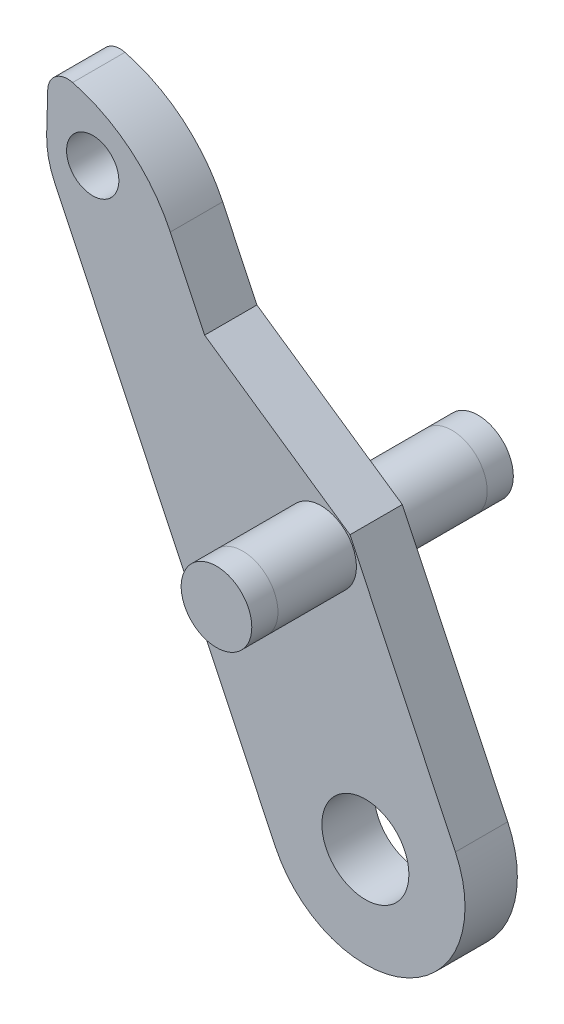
SolidWorks part; units mm, degrees
ref_plane "Plane1" through (0, 0, 0) normal (0, 0, 1) x (1, 0, 0)
ref_plane "Plane2" through (0, 0, 0) normal (0, 1, 0) x (1, 0, 0)
ref_plane "Plane3" through (0, 0, 0) normal (1, 0, 0) x (0, 0, -1)
sketch "Sketch1" plane through (0, 0, 0) normal (0, 0, 1) x (1, 0, 0)
  line L10 (91.8084, 36.1301) -> (100.2474, 18.3577)
  line L11 (107.1308, 21.6262) -> (103.0997, 30.1157)
  line L26 (103.0997, 30.1157) -> (97.5422, 33.944)
  line L27 (97.5422, 33.944) -> (96.2312, 36.705)
  line L28 (91.5444, 39.0709) -> (91.5028, 37.5807)
  circle A3 centre (103.6891, 19.992) radius 1.6637
  arc A16 (100.2474, 18.3577) -> (107.1308, 21.6262) centre (103.6891, 19.992) ccw
  arc A31 (96.2312, 36.705) -> (92.4965, 39.7874) centre (91.0686, 34.2537) ccw
  arc A32 (92.4965, 39.7874) -> (91.5444, 39.0709) centre (92.3061, 39.0496) ccw
  arc A33 (91.5028, 37.5807) -> (91.8084, 36.1301) centre (94.6765, 37.492) ccw
  dimension "D1" = 3.81
  dimension "D2" = 5.715
  dimension "D3" = 0.762
  dimension "D4" = 3.175
  dimension "D6" = 19.0576
  dimension "D7" = 11.383
  dimension "D11" = 3.3274
  dimension "D5" = 19.6742
  dimension "D8" = 3.0565
  dimension "D9" = 149.961
  dimension "D10" = 4.2418
extrude "Base-Extrude" add sketch "Sketch1" along normal mid plane 2
sketch "Sketch2" plane through (0, 0, 0) normal (0, 0, 1) x (1, 0, 0)
  circle A1 centre (102.105, 29.2498) radius 1.2446
  dimension "D1" = 2.4892
sketch "Sketch3" plane through (0, 0, 1) normal (0, 0, 1) x (1, 0, 0)
  circle A0 centre (93.2638, 37.4211) radius 1
  dimension "D1" = 2
extrude "Cut-Extrude1" cut sketch "Sketch3" against normal through all
sketch "Sketch8" plane through (0, 0, 0) normal (0, 0, 1) x (1, 0, 0)
  line L0 (103.0997, 30.1157) -> (97.5422, 33.944) construction
  line L1 (107.1308, 21.6262) -> (103.0997, 30.1157) construction
  circle A0 centre (101.9961, 29.1759) radius 1.35
  point P0 (101.9961, 29.1759)
  dimension "D1" = 1.4
  dimension "D2" = 1.4
extrude "Extrude1" add sketch "Sketch8" along normal blind 5 and the other way blind 5
sketch "Sketch5" plane through (95.7999, 45.4891, 0) normal (0.9033, 0.4289, 0) x (0, 0, -1)
  line L0 (-5, -16.0441) -> (-5, -18.7441) construction
  line L1 (-4, -12.8969) -> (-4, -22.5176)
  dimension "D1" = 1
sketch "Sketch7" plane through (97.284, 42.3636, -3.9009) normal (0.9033, 0.4289, 0) x (0, 0, -1)
  line L1 (0.0991, -7.8724) -> (0.0991, -22.5176)
  line L2 (-2.9009, -22.9564) -> (-2.9009, -13.5584) construction
  line L3 (1.0991, -15.2841) -> (1.0991, -12.5841) construction
  dimension "D1" = 1
